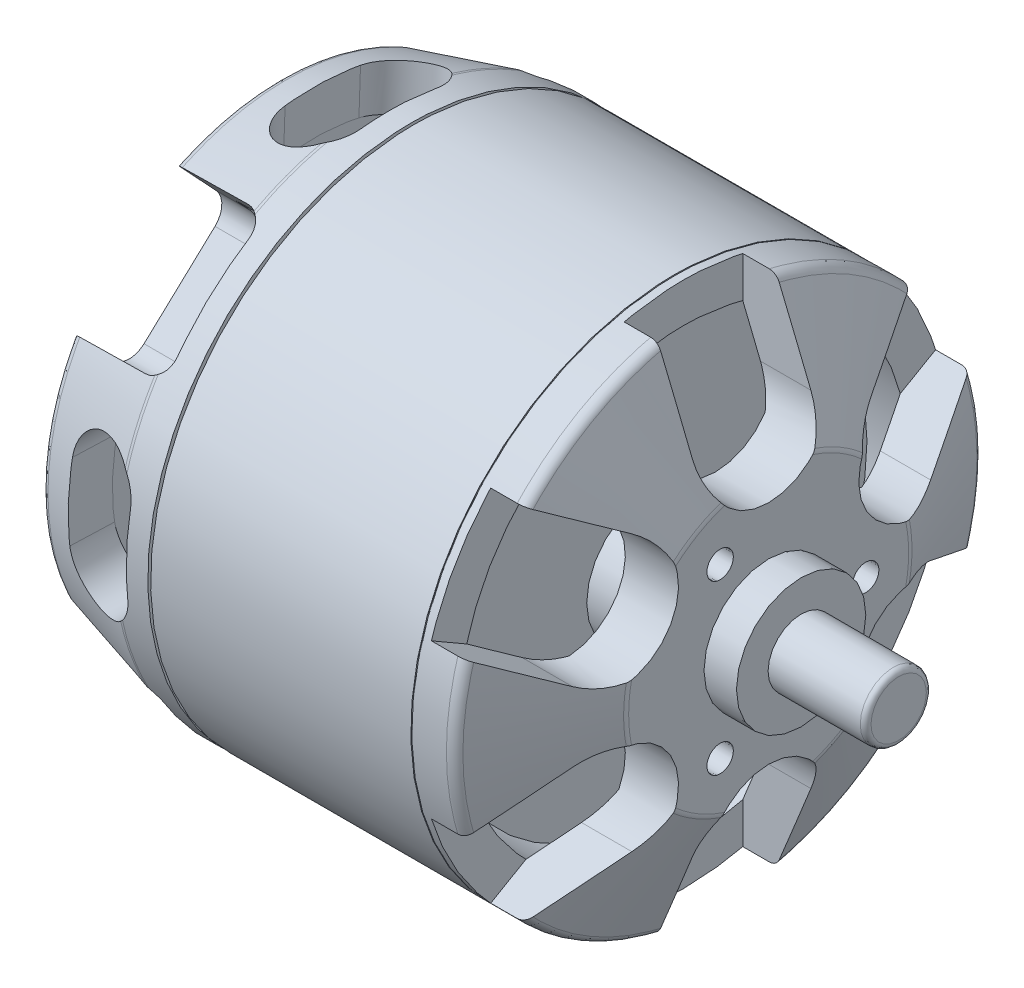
SolidWorks part; units mm, degrees
ref_plane "前视基准面" through (0, 0, 0) normal (0, 0, 1) x (1, 0, 0)
ref_plane "上视基准面" through (0, 0, 0) normal (0, 1, 0) x (1, 0, 0)
ref_plane "右视基准面" through (0, 0, 0) normal (1, 0, 0) x (0, 0, -1)
imported_body "Scorpion_SII-4020-540KV.stp<1>"
scale "缩放比例2" bodies to scale 101 102 scale about origin uniform scaling yes scale factor 0.7
sketch "草图2" plane through (0, 0, 0) normal (0, 1, 0) x (1, 0, 0)
  line L1 (60.9223, 16.9406) -> (77.7547, 16.9406)
  line L2 (60.9223, 16.9406) -> (60.9223, -15.8216)
  line L3 (60.9223, -15.8216) -> (77.7547, -15.8216)
  line L4 (77.7547, 16.9406) -> (77.7547, -15.8216)
extrude "切除-拉伸1" cut sketch "草图2" against normal blind 118
scale "缩放比例3" bodies to scale 107 105 scale about origin uniform scaling yes scale factor 0.7
